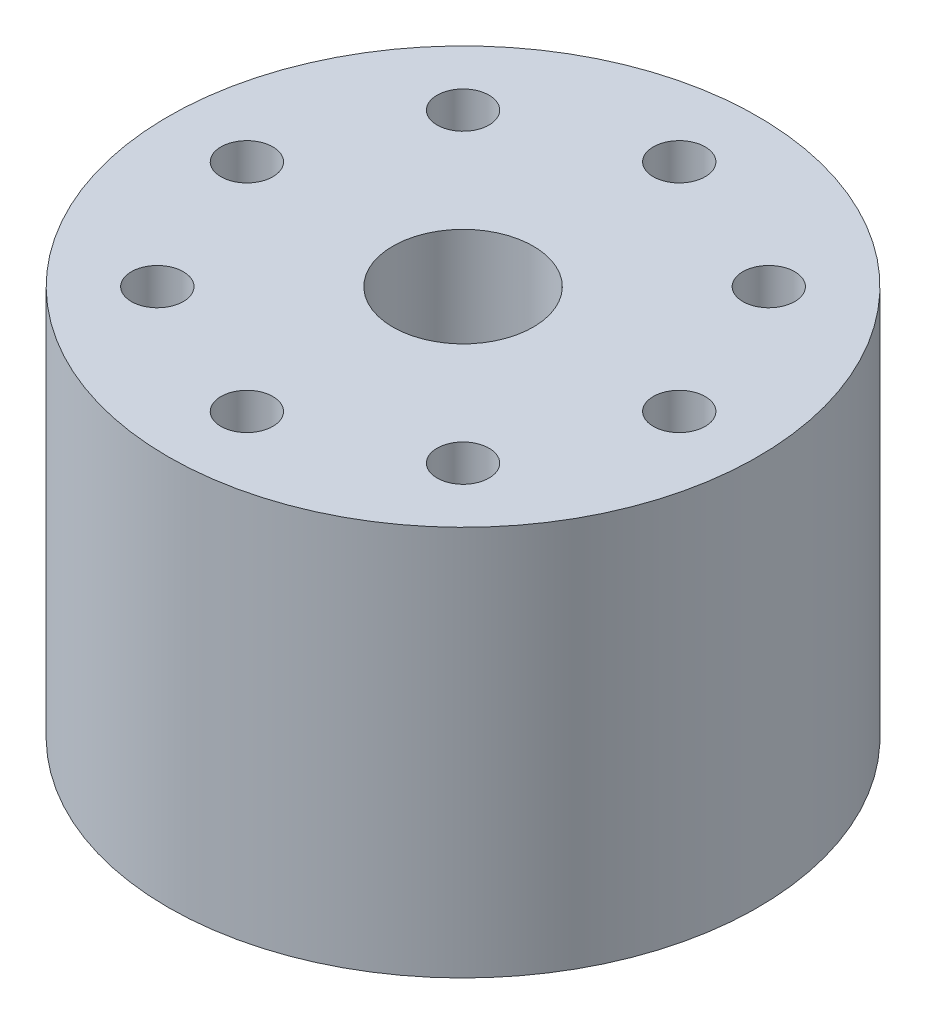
SolidWorks part; units mm, degrees
ref_plane "Front Plane" through (0, 0, 0) normal (0, 0, 1) x (1, 0, 0)
ref_plane "Top Plane" through (0, 0, 0) normal (0, 1, 0) x (1, 0, 0)
ref_plane "Right Plane" through (0, 0, 0) normal (1, 0, 0) x (0, 0, -1)
sketch "Sketch1" plane through (0, 0, 0) normal (0, 1, 0) x (1, 0, 0)
  circle A0 centre (0, 0) radius 37.5
  dimension "D1" = 75
extrude "Outer Cylinder" add sketch "Sketch1" along normal blind 49.65
sketch "Sketch2" plane through (0, 49.65, 0) normal (0, 1, 0) x (1, 0, 0)
  circle A0 centre (0, 0) radius 8.93
  dimension "D1" = 17.86
extrude "NPT Hole" cut sketch "Sketch2" against normal blind 23
sketch "Sketch3" plane through (0, 0, 0) normal (0, -1, 0) x (1, 0, 0)
  circle A0 centre (0, 0) radius 7
  dimension "D1" = 14
extrude "Outer Leaflet Diameter" cut sketch "Sketch3" against normal blind 5
sketch "Sketch4" plane through (0, 0, 0) normal (0, -1, 0) x (1, 0, 0)
  circle A0 centre (0, 0) radius 11
  dimension "D1" = 22
extrude "Depth" cut sketch "Sketch4" against normal blind 3.15
ref_plane "Plane1" through (0, 3.15, 0) normal (0, -1, 0) x (-1, 0, 0)
sketch "Sketch6" plane through (0, 0, 0) normal (0, 0, 1) x (1, 0, 0)
  line L0 (0, 3.15) -> (-7, 3.15)
  line L1 (-11, 3.15) -> (11, 3.15) construction
  line L2 (0, 3.15) -> (0, 13.09)
  line L3 (0, 13.09) -> (-7, 13.09)
  spline S0 degree 2 poles (-7, 13.09) (-11.2, 8.12) (-7, 3.15) knots 0 0 0 1 1 1
revolve "Aortic Root" cut sketch "Sketch6" angle 360 about L2
ref_plane "Plane3" through (0, 26.65, 0) normal (0, 1, 0) x (1, 0, 0)
ref_plane "Plane5" through (0, 13.09, 0) normal (0, -1, 0) x (-1, 0, 0)
sketch "Sketch8" plane through (0, 0, 0) normal (0, 0, 1) x (1, 0, 0)
  line L0 (0, 26.65) -> (0, 13.09)
  line L1 (8.93, 26.65) -> (-8.93, 26.65) construction
  line L2 (-7, 13.09) -> (7, 13.09) construction
  line L3 (0, 13.09) -> (-7, 13.09)
  line L4 (-7, 13.09) -> (-7, 26.65)
  line L5 (-7, 26.65) -> (0, 26.65)
revolve "Ascending Aorta" cut sketch "Sketch8" angle 360 about L0
sketch "Sketch9" plane through (0, 49.65, 0) normal (0, 1, 0) x (1, 0, 0)
  line L0 (0, 0) -> (0, -27.5) construction
  line L1 (0, 0) -> (-19.4454, -19.4454) construction
  circle A0 centre (0, -27.5) radius 3.3
  circle A1 centre (0, 0) radius 27.5
  circle A2 centre (-19.4454, -19.4454) radius 3.3
  circle A3 centre (-27.5, 0) radius 3.3
  circle A4 centre (-19.4454, 19.4454) radius 3.3
  circle A5 centre (0, 27.5) radius 3.3
  circle A6 centre (19.4454, 19.4454) radius 3.3
  circle A7 centre (27.5, 0) radius 3.3
  circle A8 centre (19.4454, -19.4454) radius 3.3
  dimension "D1" = 6.6
  dimension "D3" = 55
  dimension "D2" = 27.5
  dimension "D5" = 45
  dimension "D4" = 8
extrude "Bolt Holes" cut sketch "Sketch9" against normal through all contours A1 A8 | A1 A7 | A1 A6 | A1 A6 | A1 A5 | A1 A5 | A1 A4 | A1 A4 | A1 A3 | A1 A3 | A1 A2 | A1 A2 | A0 A1 | A1 A0 | A1 A8
chamfer "Chamfer1" distance 2 angle 70 1 edges at (-7, 26.65, 0)
equation "\"A\"= 14"
equation "\"Outer Leaflet Diameter\"= \"A\""
equation "\"Aortic Root Height\"= .71 * \"A\""
equation "\"D2@Sketch6\"=\"A\"/2"
equation "\"D3@Sketch6\"= \"A\" / 2"
equation "\"Max Diameter Height\"= \"A\" * ( .71 / 2 )"
equation "\"Max Diameter\"= \"A\" * ( .65 )"
equation "\"D2@Sketch8\"=\"A\"/2"
